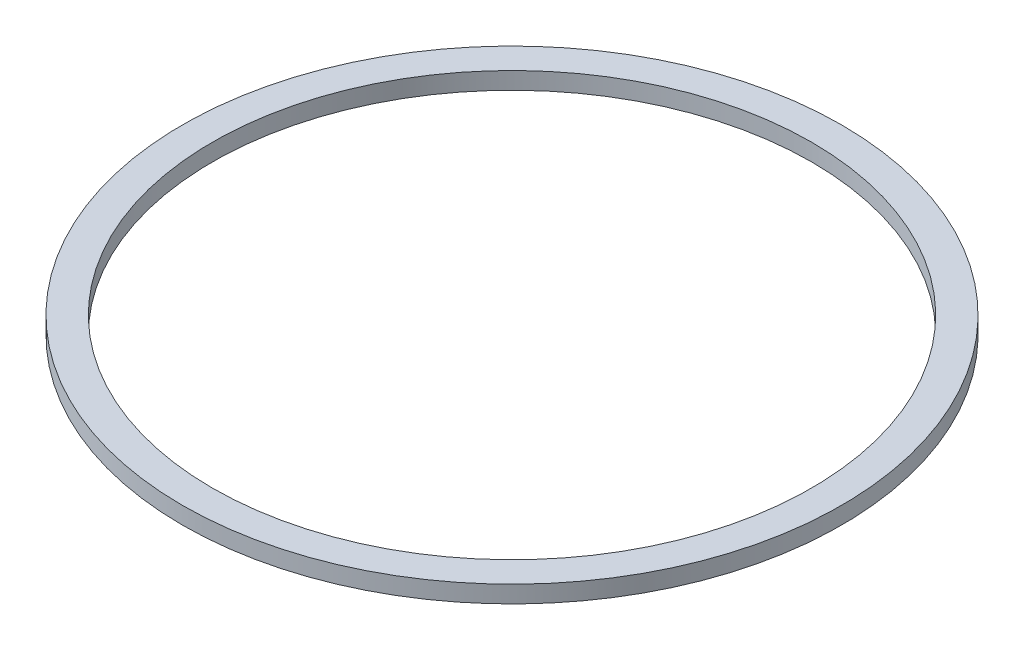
SolidWorks part; units mm, degrees
ref_plane "Спереди" through (0, 0, 0) normal (0, 0, 1) x (1, 0, 0)
ref_plane "Сверху" through (0, 0, 0) normal (0, 1, 0) x (1, 0, 0)
ref_plane "Справа" through (0, 0, 0) normal (1, 0, 0) x (0, 0, -1)
sketch "Эскиз1" plane through (0, 0, 0) normal (0, 1, 0) x (1, 0, 0)
  circle A0 centre (0, 0) radius 19.25
  circle A1 centre (0, 0) radius 17.5
  dimension "D1" = 35
  dimension "D2" = 38.5
extrude "Бобышка-Вытянуть1" add sketch "Эскиз1" along normal blind 1
